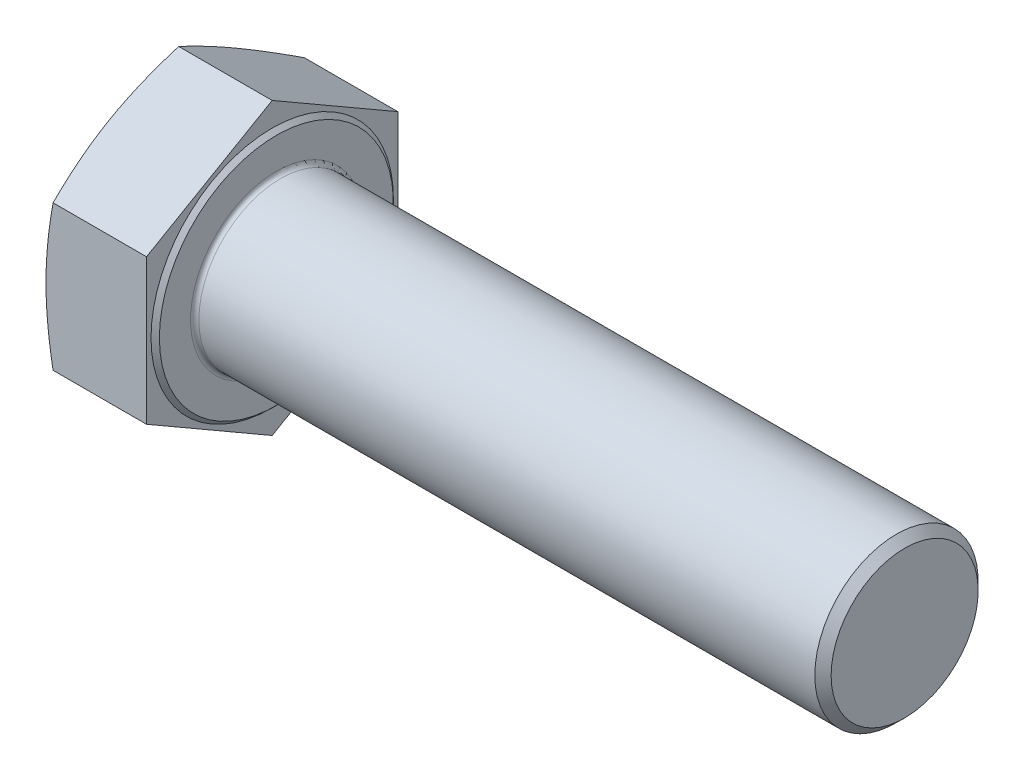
SolidWorks part; units mm, degrees
ref_plane "Front" through (0, 0, 0) normal (0, 0, 1) x (1, 0, 0)
ref_plane "Top" through (0, 0, 0) normal (0, 1, 0) x (1, 0, 0)
ref_plane "Right" through (0, 0, 0) normal (1, 0, 0) x (0, 0, -1)
sketch "Sketch2" plane through (0, 0, 0) normal (1, 0, 0) x (0, 0, -1)
  line L1 (0, -34.641) -> (30, -17.3205)
  line L2 (30, -17.3205) -> (30, 17.3205)
  line L3 (30, 17.3205) -> (0, 34.641)
  line L4 (0, 34.641) -> (-30, 17.3205)
  line L5 (-30, 17.3205) -> (-30, -17.3205)
  line L6 (-30, -17.3205) -> (0, -34.641)
  circle A0 centre (0, 0) radius 30 construction
  dimension "s" = 60
extrude "BaseHead" add sketch "Sketch2" along normal blind 25
sketch "Sketch3" plane through (0, 0, 0) normal (0, 0, 1) x (1, 0, 0)
  line L0 (25, 34.641) -> (25, 27.93)
  line L2 (25, 27.93) -> (24, 28.93)
  line L3 (24, 28.93) -> (24, 34.641)
  line L5 (24, 34.641) -> (25, 34.641)
  line L6 (-0.9571, 0) -> (7.6478, 0) construction
  line L7 (25, 34.641) -> (0, 34.641) construction
  dimension "D1" = 45
  dimension "c" = 1
  dimension "dw" = 55.86
revolve "BearingFace" cut sketch "Sketch3" angle 360 about L6
sketch "Sketch4" plane through (0, 0, 0) normal (0, 0, 1) x (1, 0, 0)
  line L0 (-0.4935, 0) -> (3.5626, 0) construction
  line L2 (0, 34.641) -> (1.6892, 34.641)
  line L4 (1.6892, 34.641) -> (0, 30)
  line L6 (0, 30) -> (0, 34.641)
  line L7 (24, 34.641) -> (0, 34.641) construction
  dimension "D1" = 20
  dimension "D2" = 60
revolve "HeadChamfer" cut sketch "Sketch4" angle 360 about L0
ref_plane "Plane1" through (85, 0, 0) normal (1, 0, 0) x (0, 0, -1)
sketch "Sketch5" plane through (25, 0, 0) normal (1, 0, 0) x (0, 0, -1)
  circle A0 centre (0, 0) radius 19.5
  dimension "d" = 39
extrude "BaseBody" add sketch "Sketch5" along normal blind 150
chamfer "Chamfer1" distance 1.95 angle 45 1 edges at (175, 0, -19.5)
fillet "HeadFillet" radius 1 1 edges at (25, 0, -19.5)
equation "\"D2@Sketch4\" = \"s@Sketch2\""
equation "\"D1@Chamfer1\" = 0.05 * \"d@Sketch5\""
equation "\"D1@ThreadCosmetic1\" = \"l@BaseBody\" - \"lg@Plane1\""
